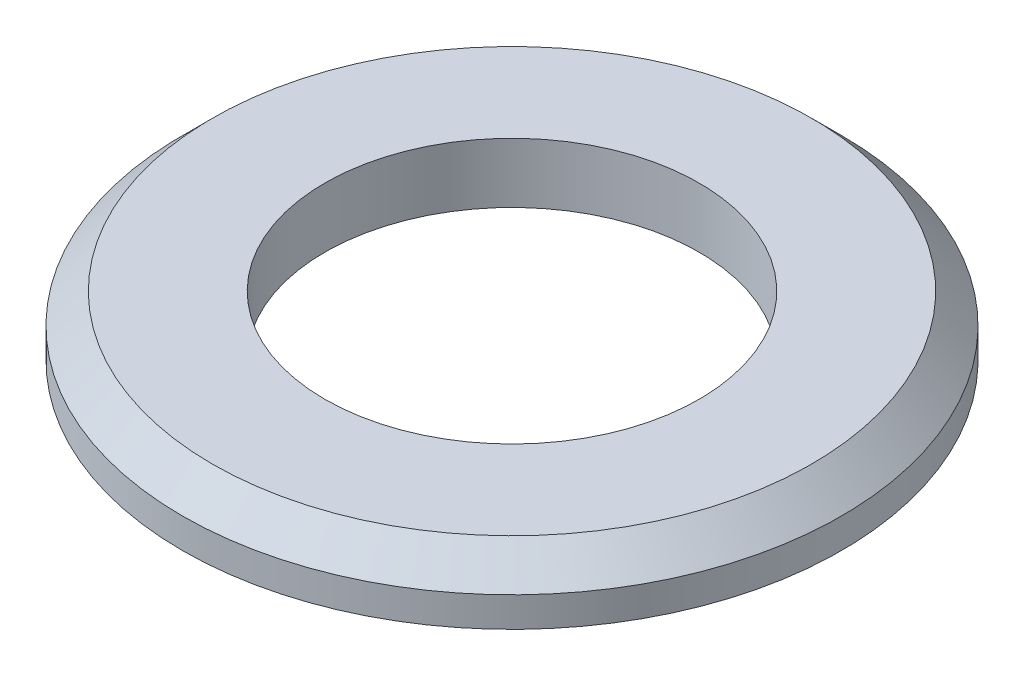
SolidWorks part; units mm, degrees
ref_plane "Front" through (0, 0, 0) normal (0, 0, 1) x (1, 0, 0)
ref_plane "Top" through (0, 0, 0) normal (0, 1, 0) x (1, 0, 0)
ref_plane "Right" through (0, 0, 0) normal (1, 0, 0) x (0, 0, -1)
sketch "Sketch1" plane through (0, 0, 0) normal (0, 1, 0) x (1, 0, 0)
  circle A0 centre (0, 0) radius 12.5
  circle A1 centre (0, 0) radius 22
extrude "Extrude1" add sketch "Sketch1" along normal blind 4
chamfer "Chamfer1" distance 2 1 edges at (0, 4, 22)
